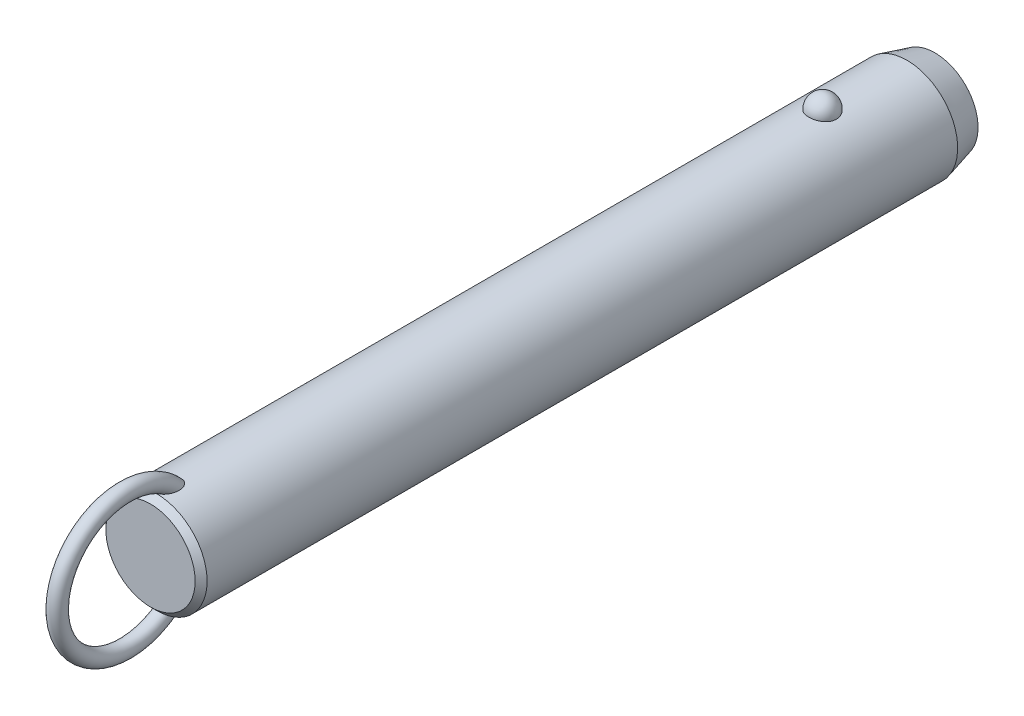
SolidWorks part; units mm, degrees
ref_plane "Front Plane" through (0, 0, 0) normal (0, 0, 1) x (1, 0, 0)
ref_plane "Top Plane" through (0, 0, 0) normal (0, 1, 0) x (1, 0, 0)
ref_plane "Right Plane" through (0, 0, 0) normal (1, 0, 0) x (0, 0, -1)
sketch "Sketch2" plane through (0, 0, 0) normal (0, 0, 1) x (1, 0, 0)
  circle A0 centre (0, 0) radius 12.7
  point P3 (0, 12.7)
  dimension "D1" = 25.4
extrude "Boss-Extrude1" add sketch "Sketch2" along normal blind 152.4
sketch "Sketch3" plane through (0, 0, 0) normal (0, 0, -1) x (-1, 0, 0)
  circle A0 centre (0, 0) radius 12.7
  dimension "D1" = 25.4
extrude "Boss-Extrude2" add sketch "Sketch3" along normal blind 31.7
chamfer "Chamfer1" distance 7 angle 15 1 edges at (-12.7, 0, -31.7)
sketch "Sketch12" plane through (0, 0, 0) normal (1, 0, 0) x (0, 0, -1)
  line L0 (-152.4, 12.7) -> (-152.4, -12.7) construction
  point P0 (-152.4, 0)
sketch "Sketch13" plane through (0, 0, 0) normal (1, 0, 0) x (0, 0, -1)
  circle A0 centre (-171.45, 0) radius 19.05
  point P2 (-152.4, 0)
  dimension "D1" = 38.1
sketch "Sketch14" plane through (0, 0, 0) normal (0, 1, 0) x (1, 0, 0)
  circle A0 centre (0, -154.4) radius 2
  point P2 (0, -152.4)
  dimension "D1" = 4
sweep "Sweep1" add profiles "Sketch14" path "Sketch13"
sketch "Sketch15" plane through (0, 0, 152.4) normal (0, 0, 1) x (1, 0, 0)
  circle A0 centre (0, 0) radius 12.7
  dimension "D1" = 25.4
extrude "Boss-Extrude3" add sketch "Sketch15" along normal blind 12.7
chamfer "Chamfer2" distance 1.5 angle 45 1 edges at (12.7, 0, 165.1)
sketch "Sketch18" plane through (0, 0, 0) normal (1, 0, 0) x (0, 0, -1)
  line L0 (24.7, 12.7) -> (-157.251, 12.7) construction
  line L1 (3.5, 16.2) -> (3.5, 9.2)
  line L2 (-157.251, -12.7) -> (24.7, -12.7) construction
  arc A0 (3.5, 16.2) -> (3.5, 9.2) centre (3.5, 12.7) ccw
  point P4 (0, 12.7)
  dimension "D1" = 28.9
revolve "Revolve1" add sketch "Sketch18" angle 360 about L1
